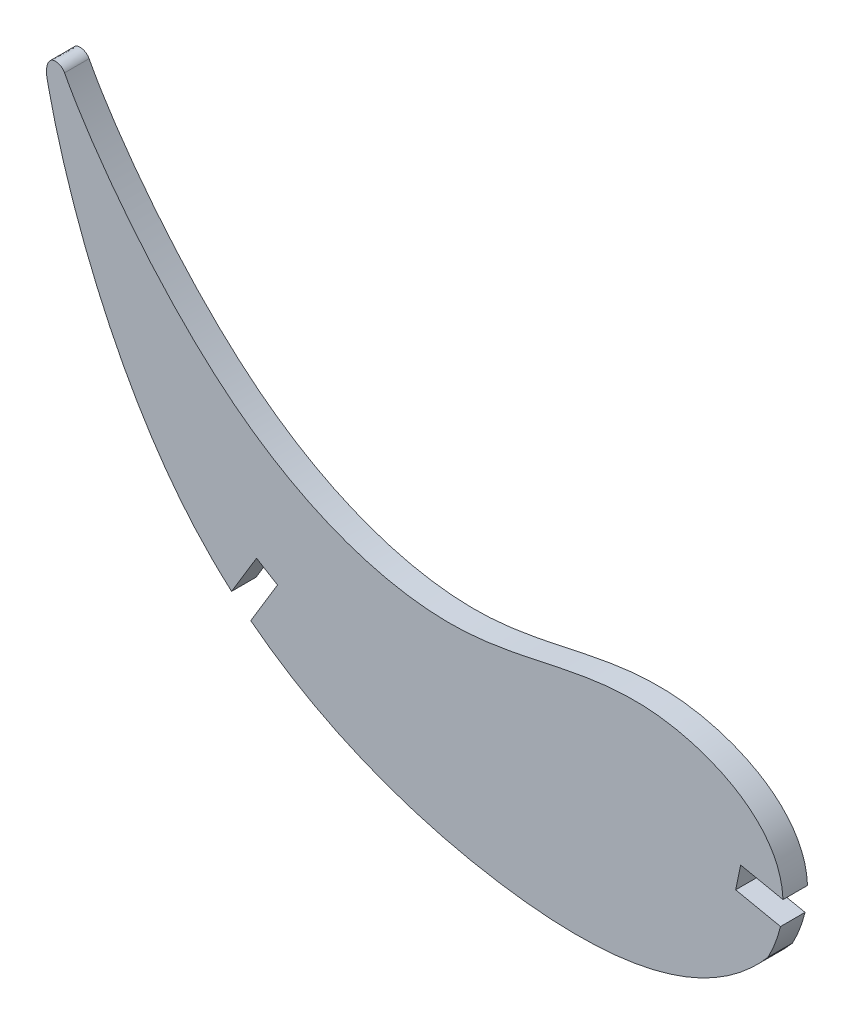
SolidWorks part; units mm, degrees
ref_plane "Ebene vorne" through (0, 0, 0) normal (0, 0, 1) x (1, 0, 0)
ref_plane "Ebene oben" through (0, 0, 0) normal (0, 1, 0) x (1, 0, 0)
ref_plane "Ebene rechts" through (0, 0, 0) normal (1, 0, 0) x (0, 0, -1)
sketch "Skizze1" plane through (0, 0, 0) normal (0, 0, 1) x (1, 0, 0)
  line L0 (-35.7384, 6.168) -> (-38.9654, 0.839)
  line L1 (-33.0225, 4.5234) -> (-36.4917, -1.2056)
  line L2 (-35.7384, 6.168) -> (-33.0225, 4.5234)
  line L3 (26.9188, 3.1087) -> (32.4028, 1.9705)
  line L4 (32.0819, -1.2056) -> (26.2735, 0)
  line L5 (26.9188, 3.1087) -> (26.2735, 0)
  line L6 (26.5961, 1.5544) -> (-43.0466, 16.0095) construction
  line L7 (-34.3804, 5.3457) -> (-26.6394, 18.1291) construction
  spline S1 degree 3 poles (-38.9654, 0.839) (-40.5056, 2.1889) (-53.2789, 14.7014) (-60.3394, 34.8076) (-62.6558, 45.4575) knots 18.869255 18.869255 18.869255 18.869255 19 20 20 20 20
  spline S2 degree 3 poles (-62.6558, 45.4575) (-62.7776, 46.0646) (-63.1325, 47.2648) (-62.4201, 49.2505) (-60.8618, 48.7162) (-60.5864, 48.1506) knots 20 20 20 20 21 22 23 23 23 23
  spline S3 degree 3 poles (-60.5864, 48.1506) (-57.2687, 41.7687) (-39.8515, 17.9853) (-8.3782, 7.6789) (13.3476, 18.7404) (32.1175, 9.5246) (32.4028, 1.9705) knots 23 23 23 23 24 25 26 26.775937 26.775937 26.775937 26.775937
  spline S7 degree 2 poles (32.0819, -1.2056) (31.5417, -3.4397) (30.4569, -5.4661) knots 0 0 0 0.180007 0.180007 0.180007 weights 1 0.991931 1
  spline S8 degree 3 poles (30.4569, -5.4661) (22.4884, -14.7974) (0.1609, -18.0991) (-26.6749, -8.8577) (-36.4917, -1.2056) knots 27.476659 27.476659 27.476659 27.476659 28.476659 29.277345 29.277345 29.277345 29.277345
  dimension "D1" = 109.471
extrude "Aufsatz-Linear austragen1" add sketch "Skizze1" along normal mid plane 3.175
ref_plane "Ebene2" through (-27.5245, 16.6675, 0) normal (0.8554, -0.518, 0) x (0, 0, -1)
ref_plane "Ebene3" through (1.4078, 6.7825, 0) normal (-0.2032, -0.9791, 0) x (0.9791, -0.2032, 0)
